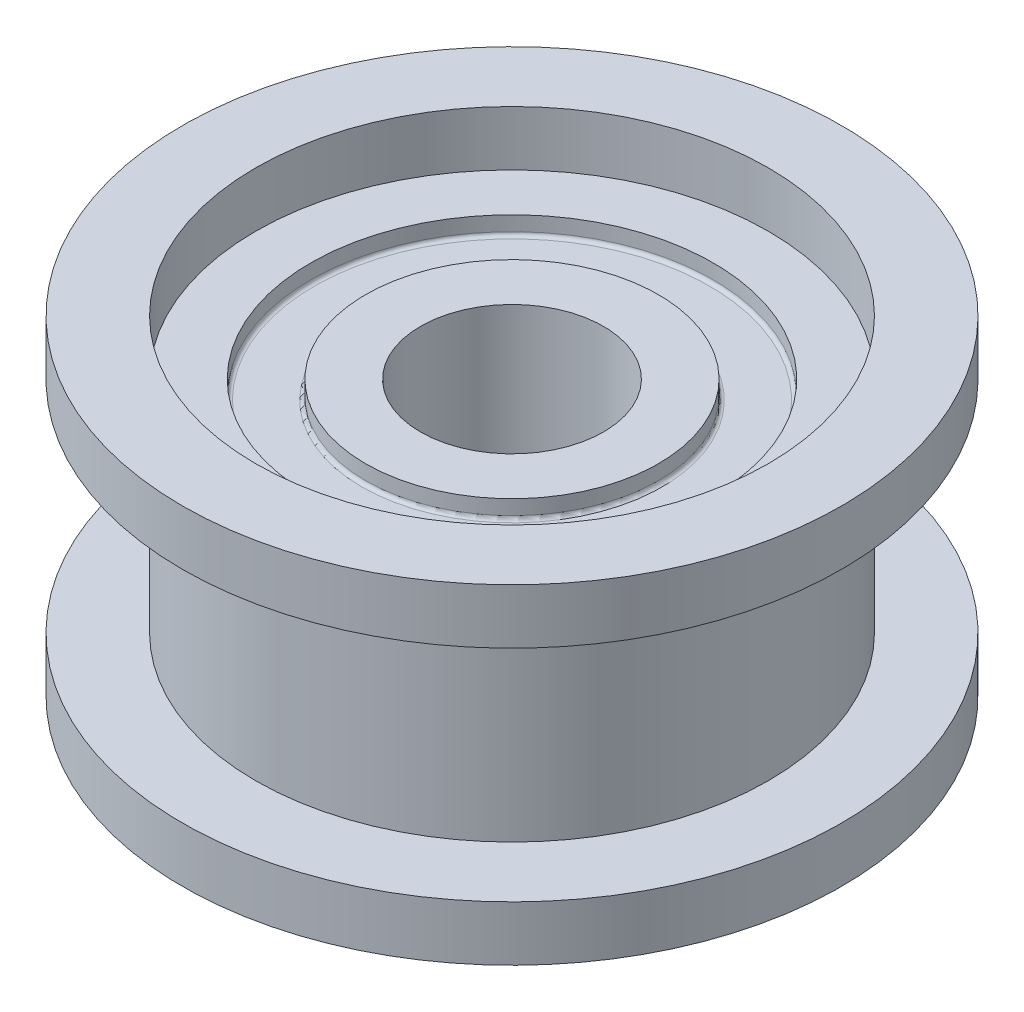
SolidWorks part; units mm, degrees
ref_plane "Piano frontale" through (0, 0, 0) normal (0, 0, 1) x (1, 0, 0)
ref_plane "Piano superiore" through (0, 0, 0) normal (0, 1, 0) x (1, 0, 0)
ref_plane "Piano destro" through (0, 0, 0) normal (1, 0, 0) x (0, 0, -1)
sketch "Schizzo1" plane through (0, 0, 0) normal (0, 1, 0) x (1, 0, 0)
  circle A0 centre (0, 0) radius 7
  circle A1 centre (0, 0) radius 2.5
  dimension "D1" = 14
  dimension "D2" = 5
extrude "Estrusione-Estrusione1" add sketch "Schizzo1" along normal blind 6
sketch "Schizzo2" plane through (0, 6, 0) normal (0, 1, 0) x (1, 0, 0)
  circle A0 centre (0, 0) radius 5.5
  circle A1 centre (0, 0) radius 4
  dimension "D1" = 11
  dimension "D2" = 8
extrude "Taglio-Estrusione1" cut sketch "Schizzo2" against normal blind 0.5
sketch "Schizzo3" plane through (0, 0, 0) normal (0, -1, 0) x (1, 0, 0)
  circle A0 centre (0, 0) radius 4
  circle A1 centre (0, 0) radius 5.5
  dimension "D1" = 11
  dimension "D2" = 8
extrude "Taglio-Estrusione2" cut sketch "Schizzo3" against normal blind 0.5
fillet "Raccordo1" radius 0.1 4 edges at (0, 5.5, 5.5) (0, 5.5, 4) (0, 0.5, -5.5) (0, 0.5, -4)
sketch "Schizzo4" plane through (0, 0, 0) normal (0, -1, 0) x (1, 0, 0)
  circle A0 centre (0, 0) radius 5.5
  circle A1 centre (0, 0) radius 9
  dimension "D1" = 18
extrude "Estrusione-Estrusione2" add sketch "Schizzo4" along normal blind 1.5
sketch "Schizzo5" plane through (0, 6, 0) normal (0, 1, 0) x (1, 0, 0)
  circle A0 centre (0, 0) radius 7
  circle A1 centre (0, 0) radius 9
  dimension "D1" = 18
extrude "Estrusione-Estrusione3" add sketch "Schizzo5" along normal blind 1.5 separate body
